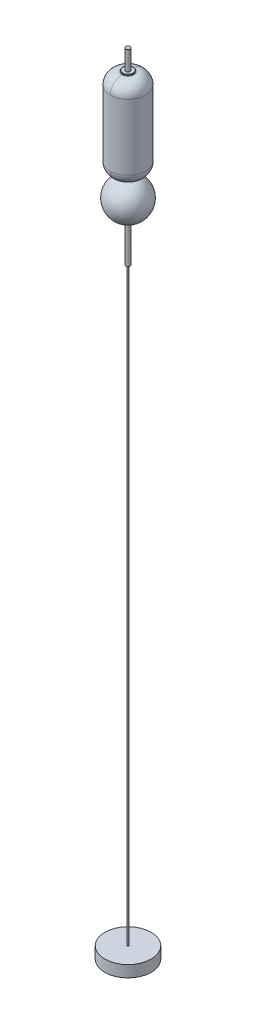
SolidWorks part; units mm, degrees
ref_plane "Alzado" through (0, 0, 0) normal (0, 0, 1) x (1, 0, 0)
ref_plane "Planta" through (0, 0, 0) normal (0, 1, 0) x (1, 0, 0)
ref_plane "Vista lateral" through (0, 0, 0) normal (1, 0, 0) x (0, 0, -1)
imported_body "C1206.IGS<1>"
delete or keep bodies "Sólido-Eliminar/Conservar 1" type delete bodies bodies 108
ref_plane "Plano1" through (0, 150.35, 0) normal (0, 1, 0) x (1, 0, 0)
sketch "Croquis2" plane through (0, 150.35, 0) normal (0, 1, 0) x (1, 0, 0)
  circle A0 centre (0, 0) radius 1.524
  dimension "D1" = 3.048
extrude "Saliente-Extruir1" add sketch "Croquis2" against normal blind 1524 separate body
sketch "Croquis3" plane through (0, -1373.65, 0) normal (0, -1, 0) x (1, 0, 0)
  circle A0 centre (0, 0) radius 59.944
  dimension "D1" = 119.888
extrude "Saliente-Extruir2" add sketch "Croquis3" along normal blind 29.972
